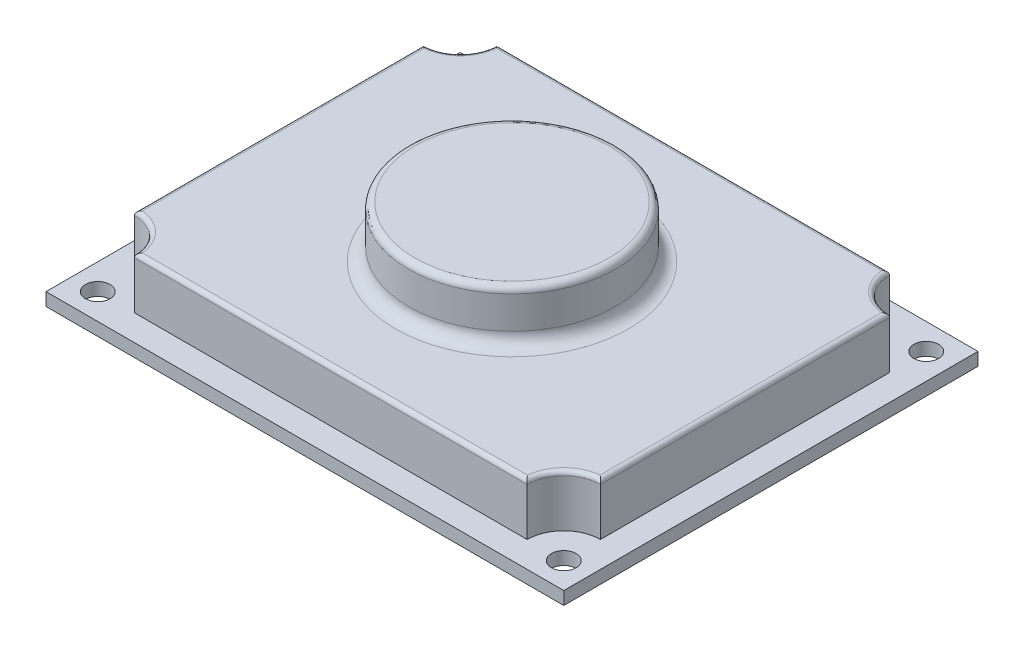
SolidWorks part; units mm, degrees
ref_plane "Front Plane" through (0, 0, 0) normal (0, 0, 1) x (1, 0, 0)
ref_plane "Top Plane" through (0, 0, 0) normal (0, 1, 0) x (1, 0, 0)
ref_plane "Right Plane" through (0, 0, 0) normal (1, 0, 0) x (0, 0, -1)
sketch "Sketch1"
  dimension "D1" = 254
  dimension "D2" = 203.2
extrude "Extrude1" add sketch "Sketch1" along normal blind 6.35
sketch "Sketch2"
  dimension "D1" = 12.7
extrude "Extrude2" add sketch "Sketch2" along normal blind 25.4
sketch "Sketch3"
extrude "Extrude3" cut sketch "Sketch3" against normal up to surface (25.4 mm away)
sketch "Sketch4"
extrude "Extrude4" cut sketch "Sketch4" against normal through all
sketch "Sketch5"
  dimension "D1" = 101.6
extrude "Extrude5" add sketch "Sketch5" along normal blind 25.4
fillet "Fillet2" radius 3.175 1 edges at (127, 57.15, -50.8)
fillet "Fillet3" radius 2.032 8 edges at (12.7, 31.75, -101.6) (25.4, 31.75, -177.8) (127, 31.75, -190.5) (241.3, 31.75, -101.6) (127, 31.75, -12.7) (25.4, 31.75, -25.4) (228.6, 31.75, -177.8) (228.6, 31.75, -25.4)
fillet "Fillet4" radius 6.35 1 edges at (127, 31.75, -50.8)
